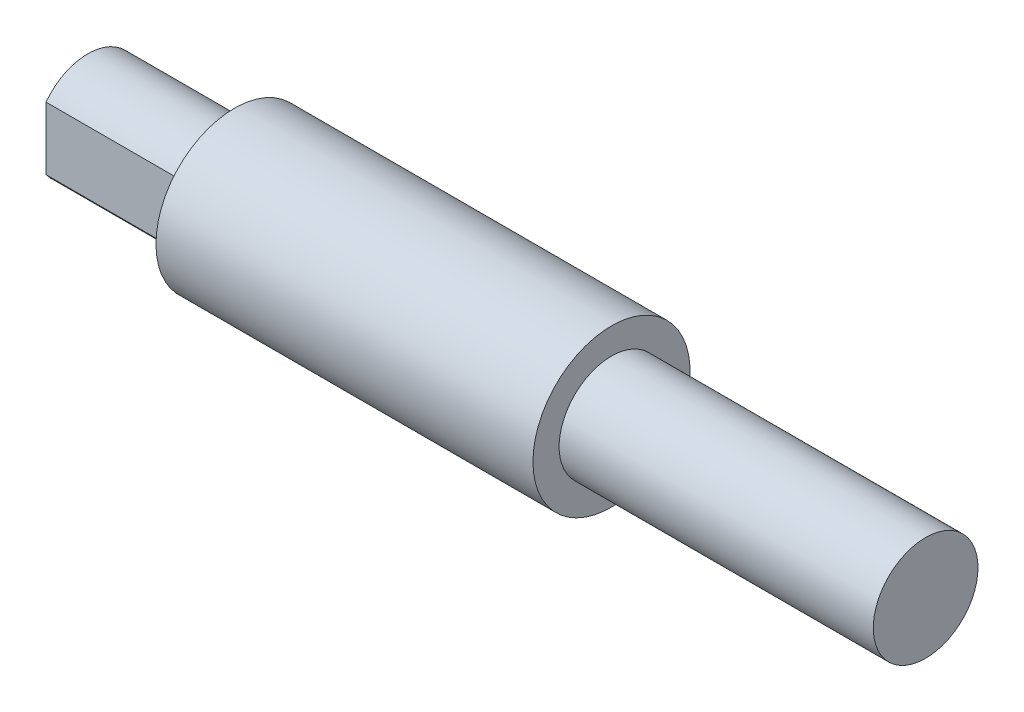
SolidWorks part; units mm, degrees
ref_plane "正面" through (0, 0, 0) normal (0, 0, 1) x (1, 0, 0)
ref_plane "平面" through (0, 0, 0) normal (0, 1, 0) x (1, 0, 0)
ref_plane "右側面" through (0, 0, 0) normal (1, 0, 0) x (0, 0, -1)
sketch "ｽｹｯﾁ1" plane through (0, 0, 0) normal (1, 0, 0) x (0, 0, -1)
  circle A0 centre (0, 0) radius 7.5
  dimension "D1" = 15
extrude "押し出し1" add sketch "ｽｹｯﾁ1" along normal blind 80
sketch "ｽｹｯﾁ2" plane through (80, 0, 0) normal (1, 0, 0) x (0, 0, -1)
  circle A0 centre (0, 0) radius 5
  dimension "D1" = 10
extrude "ｶｯﾄ - 押し出し1" cut sketch "ｽｹｯﾁ2" against normal blind 30 flip side to cut
sketch "ｽｹｯﾁ3" plane through (0, 0, 0) normal (-1, 0, 0) x (0, 0, 1)
  line L0 (-4, 3) -> (-4, -3)
  line L1 (4, 3) -> (4, -3)
  arc A0 (4, 3) -> (-4, 3) centre (0, 0) ccw
  arc A1 (-4, -3) -> (4, -3) centre (0, 0) ccw
  dimension "D2" = 10
  dimension "D1" = 8
extrude "ｶｯﾄ - 押し出し2" cut sketch "ｽｹｯﾁ3" against normal blind 14 flip side to cut
